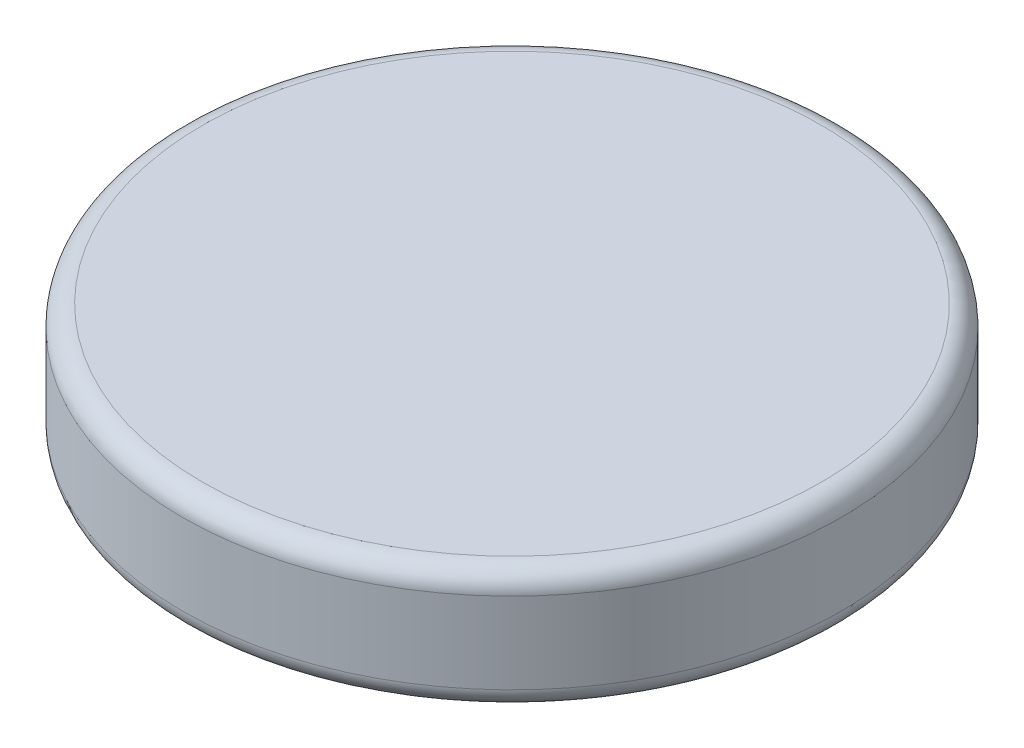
SolidWorks part; units mm, degrees
ref_plane "Front Plane" through (0, 0, 0) normal (0, 0, 1) x (1, 0, 0)
ref_plane "Top Plane" through (0, 0, 0) normal (0, 1, 0) x (1, 0, 0)
ref_plane "Right Plane" through (0, 0, 0) normal (1, 0, 0) x (0, 0, -1)
sketch "Sketch1" plane through (0, 0, 0) normal (0, 1, 0) x (1, 0, 0)
  circle A0 centre (0, 0) radius 32.5
extrude "Boss-Extrude1" add sketch "Sketch1" along normal blind 12
fillet "Fillet1" radius 2 2 edges at (0, 12, 32.5) (0, 0, 32.5)
